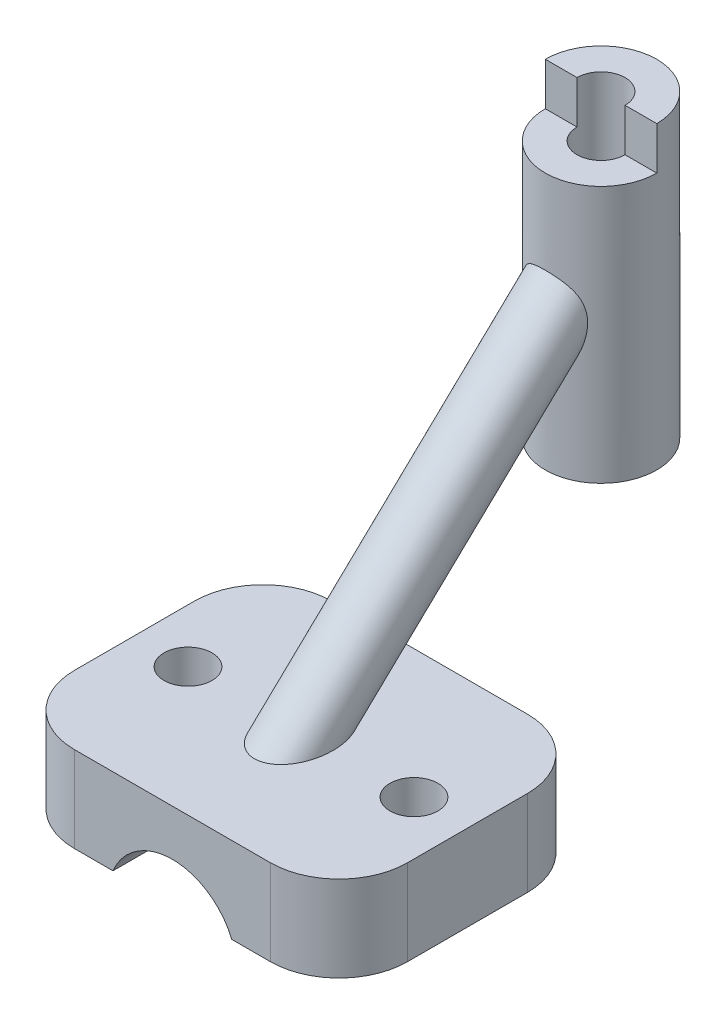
SolidWorks part; units mm, degrees
ref_plane "Front Plane" through (0, 0, 0) normal (0, 0, 1) x (1, 0, 0)
ref_plane "Top Plane" through (0, 0, 0) normal (0, 1, 0) x (1, 0, 0)
ref_plane "Right Plane" through (0, 0, 0) normal (1, 0, 0) x (0, 0, -1)
sketch "Sketch2" plane through (0, 0, 0) normal (0, 0, 1) x (1, 0, 0)
  line L0 (-24.675, 0) -> (24.675, 0)
  line L1 (-24.675, 0) -> (-24.675, -12.7)
  line L2 (-24.675, -12.7) -> (-8.8, -12.7)
  line L3 (24.675, 0) -> (24.675, -12.7)
  line L4 (24.675, -12.7) -> (8.8, -12.7)
  arc A0 (-8.8, -12.7) -> (8.8, -12.7) centre (0, -16.3451) cw
  point P7 (0, 0)
  dimension "D2" = 9.525
  dimension "D1" = 135
  dimension "D3" = 15.875
  dimension "D4" = 15.875
  dimension "D5" = 12.7
  dimension "D6" = 12.7
extrude "Boss-Extrude1" add sketch "Sketch2" along normal blind 38.1
sketch "Sketch3" plane through (0, -12.7, 0) normal (0, -1, 0) x (1, 0, 0)
  line L0 (-24.675, 38.1) -> (-24.675, 0) construction
  line L2 (-24.675, 38.1) -> (-8.8, 38.1) construction
  line L3 (0, -39.4652) -> (0, 39.4652) construction
  circle A0 centre (-16.7375, 19.05) radius 3.556
  circle A3 centre (16.7375, 19.05) radius 3.556
  dimension "D1" = 7.112
  dimension "D2" = 7.9375
  dimension "D4" = 19.05
extrude "Cut-Extrude1" cut sketch "Sketch3" against normal up to next
ref_plane "Plane2" through (0, 15.494, 0) normal (0, 1, 0) x (1, 0, 0)
sketch "Sketch4" plane through (0, 15.494, 0) normal (0, 1, 0) x (1, 0, 0)
  circle A0 centre (0, 25.4) radius 8.255
  circle A1 centre (0, 25.4) radius 3.556
  dimension "D1" = 16.51
  dimension "D2" = 7.112
  dimension "D3" = 25.4
extrude "Boss-Extrude2" add sketch "Sketch4" along normal blind 38.1 separate body
sketch "Sketch5" plane through (0, 0, 0) normal (1, 0, 0) x (0, 0, -1)
  line L0 (-19.05, 0) -> (17.145, 34.544) construction
  line L1 (-38.1, 0) -> (0, 0) construction
  line L2 (17.145, 53.594) -> (17.145, 15.494) construction
  dimension "D1" = 43.663
ref_plane "Plane3" through (0, 0, 0) normal (0, 0.6904, -0.7234) x (-1, 0, 0)
sketch "Sketch6" plane through (0, 0, 0) normal (0, 0.6904, -0.7234) x (-1, 0, 0)
  circle A0 centre (0, 13.1524) radius 4.7625
  dimension "D1" = 9.525
extrude "Boss-Extrude3" add sketch "Sketch6" along normal up to next and the other way up to next
sketch "Sketch7" plane through (0, 53.594, 0) normal (0, 1, 0) x (1, 0, 0)
  line L0 (-3.556, 25.4) -> (-8.255, 25.4)
  line L1 (3.556, 25.4) -> (8.255, 25.4)
  circle A0 centre (0, 25.4) radius 3.556 construction
  circle A1 centre (0, 25.4) radius 8.255 construction
  arc A2 (-3.556, 25.4) -> (3.556, 25.4) centre (0, 25.4) cw
  arc A3 (-8.255, 25.4) -> (8.255, 25.4) centre (0, 25.4) cw
extrude "Boss-Extrude4" add sketch "Sketch7" along normal blind 6.35
fillet "Fillet1" radius 10.16 4 edges at (-24.675, -6.35, 0) (24.675, -6.35, 0) (24.675, -6.35, 38.1) (-24.675, -6.35, 38.1)
